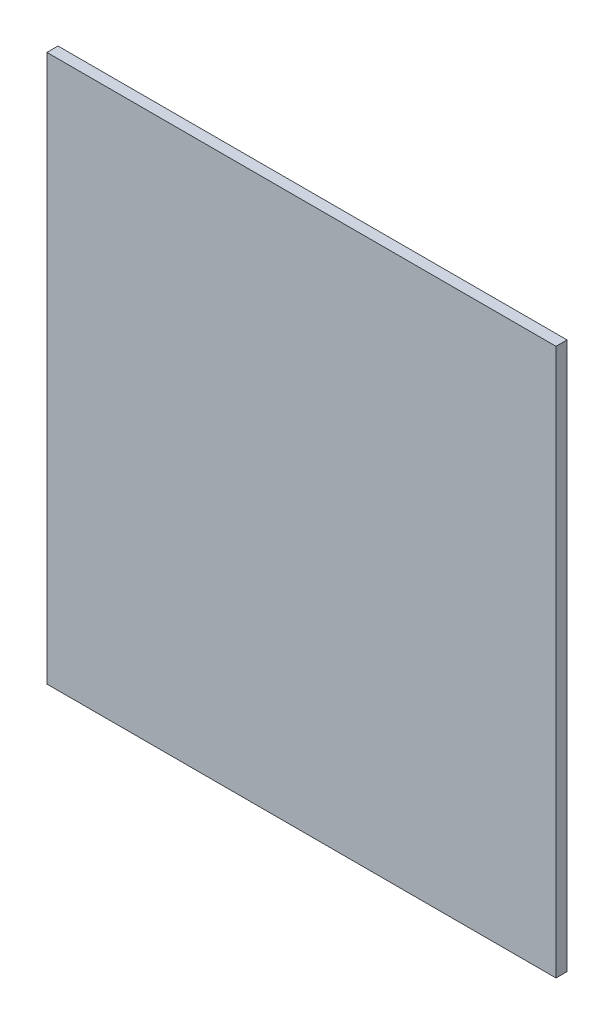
SolidWorks part; units mm, degrees
ref_plane "Front Plane" through (0, 0, 0) normal (0, 0, 1) x (1, 0, 0)
ref_plane "Top Plane" through (0, 0, 0) normal (0, 1, 0) x (1, 0, 0)
ref_plane "Right Plane" through (0, 0, 0) normal (1, 0, 0) x (0, 0, -1)
sketch "Sketch1" plane through (0, 0, 0) normal (0, 0, 1) x (1, 0, 0)
  line L0 (733.2242, -353.21) -> (733.2242, 141.1159) construction
  line L1 (273.2242, -353.21) -> (283.2242, -353.21) construction
  line L2 (273.2242, 141.1159) -> (283.2242, 141.1159) construction
  line L3 (273.2242, -353.21) -> (273.2242, 141.1159) construction
  line L4 (733.2242, -353.21) -> (733.2242, 141.1159)
  line L5 (273.2242, -353.21) -> (733.2242, -353.21)
  line L6 (273.2242, 141.1159) -> (733.2242, 141.1159)
  line L7 (273.2242, -353.21) -> (273.2242, 141.1159)
  point P3 (726.2697, 141.1159)
  point P6 (473.2986, -353.21)
  point P8 (726.8787, -353.21)
extrude "Boss-Extrude1" add sketch "Sketch1" along normal blind 10
